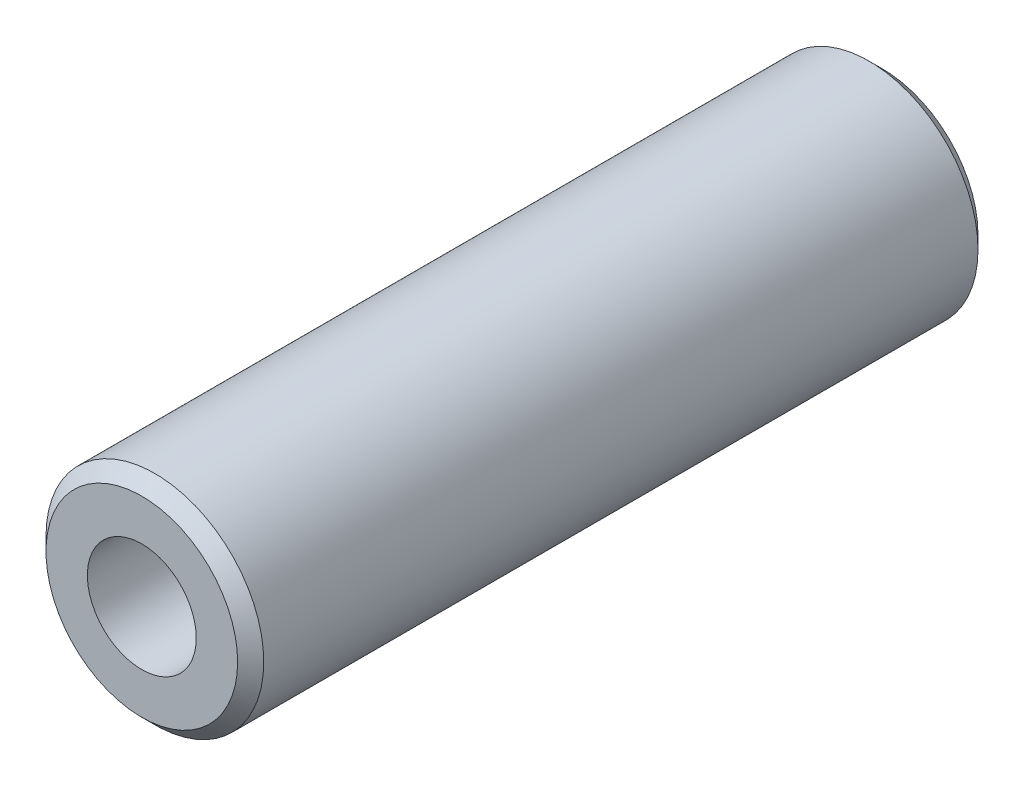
SolidWorks part; units mm, degrees
ref_plane "Front Plane" through (0, 0, 0) normal (0, 0, 1) x (1, 0, 0)
ref_plane "Top Plane" through (0, 0, 0) normal (0, 1, 0) x (1, 0, 0)
ref_plane "Right Plane" through (0, 0, 0) normal (1, 0, 0) x (0, 0, -1)
sketch "Sketch1" plane through (0, 0, 0) normal (0, 0, 1) x (1, 0, 0)
  circle A0 centre (0, 0) radius 3.175
  circle A1 centre (0, 0) radius 6.35
  dimension "D1" = 12.7
  dimension "D2" = 6.35
extrude "Boss-Extrude1" add sketch "Sketch1" along normal blind 43.18
chamfer "Chamfer1" distance 0.762 angle 45 2 edges at (6.35, 0, 0) (6.35, 0, 43.18)
